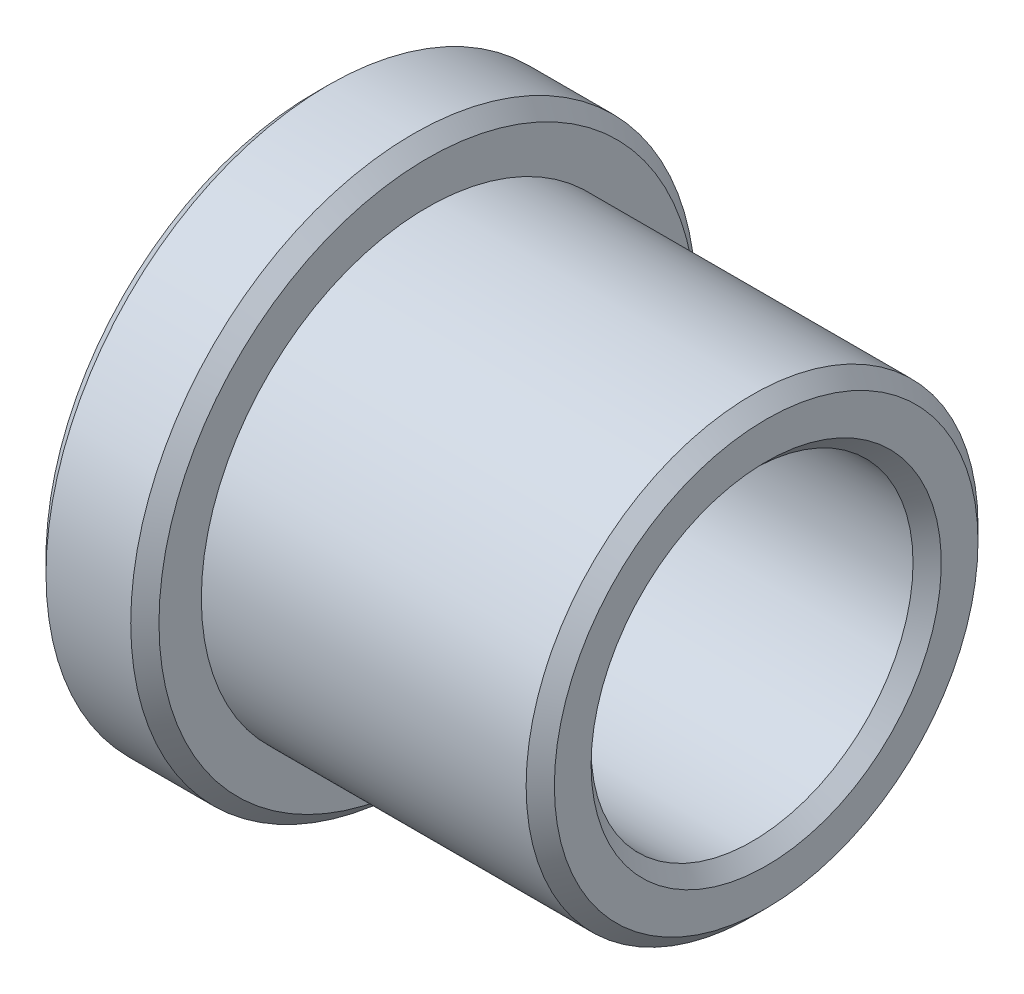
SolidWorks part; units mm, degrees
ref_plane "Front" through (0, 0, 0) normal (0, 0, 1) x (1, 0, 0)
ref_plane "Top" through (0, 0, 0) normal (0, 1, 0) x (1, 0, 0)
ref_plane "Right" through (0, 0, 0) normal (1, 0, 0) x (0, 0, -1)
sketch "Esquisse1" plane through (0, 0, 0) normal (0, 0, 1) x (1, 0, 0)
  line L0 (0, 2.85) -> (8, 2.85)
  line L1 (8, 2.85) -> (8, 4)
  line L2 (8, 4) -> (2, 4)
  line L3 (2, 4) -> (2, 5)
  line L4 (2, 5) -> (0, 5)
  line L5 (0, 5) -> (0, 2.85)
  line L6 (0, 0) -> (9.1262, 0) construction
  dimension "D1" = 5
  dimension "D2" = 2.85
  dimension "D3" = 4
  dimension "D4" = 2
  dimension "D5" = 6
revolve "Révolution1" add sketch "Esquisse1" angle 360 about L6
chamfer "Chanfrein1" distance 0.25 angle 45 5 edges at (0, 0, 2.85) (8, 0, 2.85) (8, 0, 4) (0, 0, 5) (2, 0, 5)
